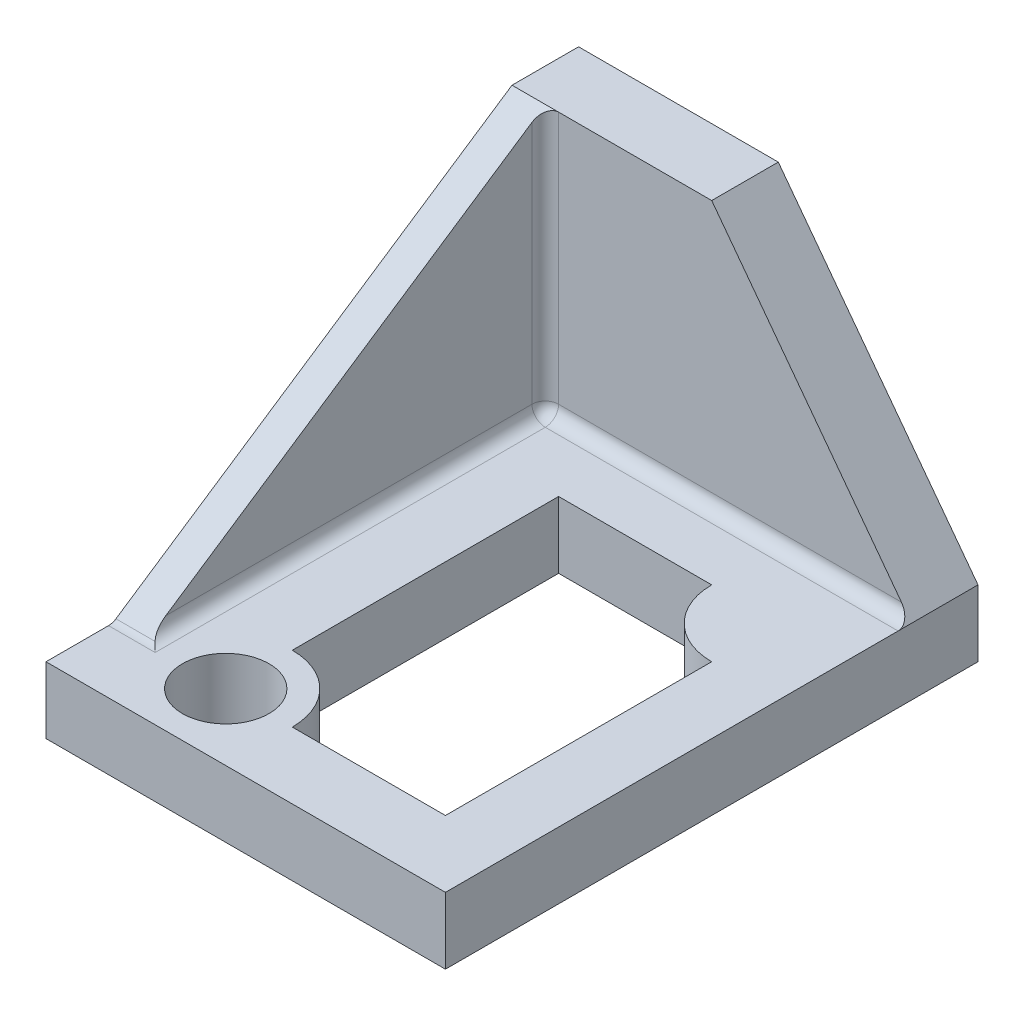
SolidWorks part; units mm, degrees
ref_plane "Front" through (0, 0, 0) normal (0, 0, 1) x (1, 0, 0)
ref_plane "Top" through (0, 0, 0) normal (0, 1, 0) x (1, 0, 0)
ref_plane "Right" through (0, 0, 0) normal (1, 0, 0) x (0, 0, -1)
sketch "Sketch2" plane through (0, 0, 0) normal (0, 0, 1) x (1, 0, 0)
  line L0 (0, 0) -> (76.2, 0)
  line L1 (76.2, 0) -> (76.2, -12.7)
  line L2 (76.2, -12.7) -> (0, -12.7)
  line L5 (0, -12.7) -> (0, 0)
  dimension "D1" = 76.2
  dimension "D4" = 12.7
extrude "Extrude1" add sketch "Sketch2" along normal blind 101.6
sketch "Sketch3" plane through (0, 0, 0) normal (-1, 0, 0) x (0, 0, 1)
  line L0 (0, 50.8) -> (12.7, 50.8)
  line L2 (0, 50.8) -> (0, 0)
  line L3 (12.7, 50.8) -> (88.9, 0)
  line L4 (101.6, 0) -> (0, 0) construction
  line L5 (88.9, 0) -> (0, 0)
  dimension "D1" = 12.7
  dimension "D2" = 50.8
  dimension "D3" = 12.7
extrude "Extrude2" add sketch "Sketch3" against normal blind 6.35
sketch "Sketch5" plane through (0, 0, 0) normal (0, 0, -1) x (-1, 0, 0)
  line L0 (-6.35, 50.8) -> (-38.1, 50.8)
  line L1 (-38.1, 50.8) -> (-76.2, 0)
  line L2 (-76.2, 0) -> (-6.35, 0) construction
  line L3 (-76.2, 0) -> (-6.35, 0)
  line L4 (-6.35, 0) -> (-6.35, 50.8)
  line L5 (0, 50.8) -> (0, -12.7) construction
  dimension "D1" = 38.1
extrude "Extrude4" add sketch "Sketch5" against normal blind 12.7
fillet "Fillet1" radius 2.54
sketch "Sketch9" plane through (0, 0, 0) normal (0, 1, 0) x (-1, 0, 0)
  line L0 (-63.5, 88.9) -> (-63.5, 38.1)
  line L1 (-21.59, 25.4) -> (-21.59, 76.2)
  line L2 (-34.29, 88.9) -> (-63.5, 88.9)
  line L3 (-50.8, 25.4) -> (-21.59, 25.4)
  line L4 (-76.2, 101.6) -> (0, 101.6) construction
  line L5 (-8.89, 12.7) -> (-38.1, 12.7) construction
  line L6 (-8.89, 15.24) -> (-8.89, 89.6691) construction
  line L7 (-76.2, 101.6) -> (-76.2, 15.24) construction
  arc A1 (-63.5, 38.1) -> (-50.8, 25.4) centre (-63.5, 25.4) cw
  arc A2 (-34.29, 88.9) -> (-21.59, 76.2) centre (-21.59, 88.9) ccw
  dimension "D6" = 12.7
  dimension "D7" = 25.4
  dimension "D1" = 12.7
  dimension "D2" = 12.7
  dimension "D3" = 12.7
  dimension "D4" = 12.7
extrude "Cut-Extrude1" cut sketch "Sketch9" against normal through all
sketch "Sketch11" plane through (0, 0, 0) normal (0, 1, 0) x (-1, 0, 0)
  circle A0 centre (-21.59, 88.9) radius 8.255
  dimension "D1" = 16.51
extrude "Cut-Extrude2" cut sketch "Sketch11" against normal through all
